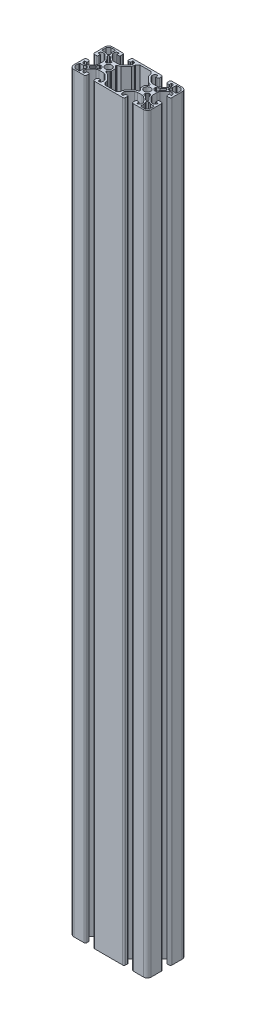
SolidWorks part; units mm, degrees
other "2018_08_28__13-15-45-812"
ref_plane "Ebene vorne" through (0, 0, 0) normal (0, 0, 1) x (1, 0, 0)
ref_plane "Ebene oben" through (0, 0, 0) normal (0, 1, 0) x (1, 0, 0)
ref_plane "Ebene rechts" through (0, 0, 0) normal (1, 0, 0) x (0, 0, -1)
imported_body "Importiert1"
sketch "Skizze1" plane through (0, 1500, 0) normal (0, 1, 0) x (1, 0, 0)
  line L1 (-42.1729, 21.5096) -> (46.3623, 21.5096)
  line L2 (-42.1729, 21.5096) -> (-42.1729, -27.1691)
  line L3 (-42.1729, -27.1691) -> (46.3623, -27.1691)
  line L4 (46.3623, 21.5096) -> (46.3623, -27.1691)
extrude "Schnitt-Linear austragen1" cut sketch "Skizze1" against normal offset from surface (2224 mm away) 776
